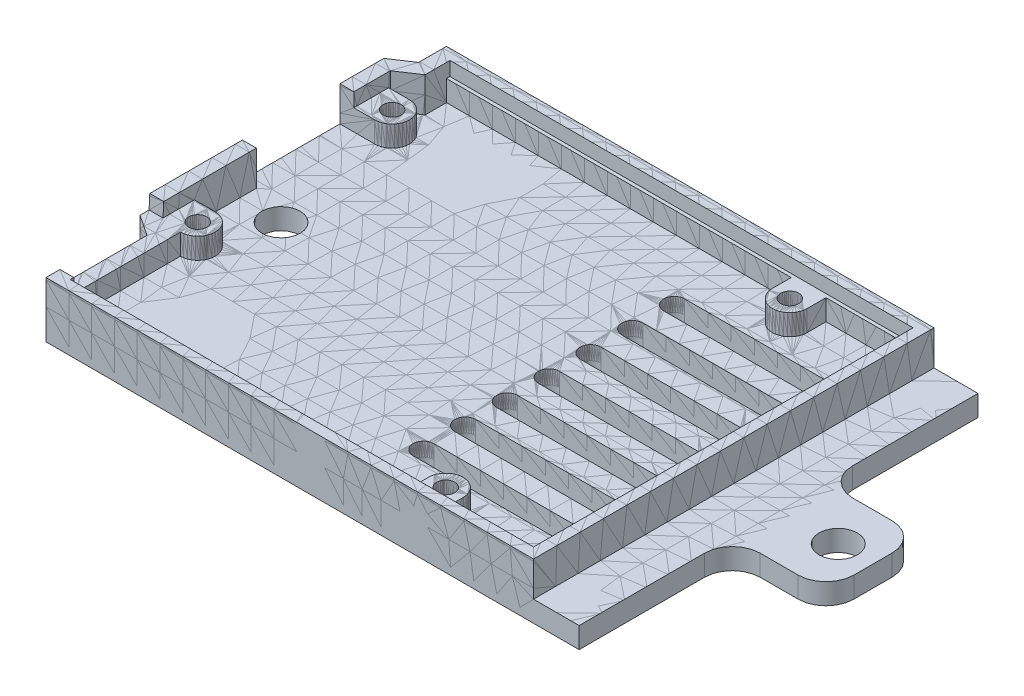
SolidWorks part; units mm, degrees
ref_plane "Alzado" through (0, 0, 0) normal (0, 0, 1) x (1, 0, 0)
ref_plane "Planta" through (0, 0, 0) normal (0, 1, 0) x (1, 0, 0)
ref_plane "Vista lateral" through (0, 0, 0) normal (1, 0, 0) x (0, 0, -1)
imported_body "Sólido importado1"
sketch "Croquis5" plane through (0, -1, 0) normal (0, -1, 0) x (1, 0, 0)
  line L0 (-66.2, 50.3497) -> (-66.2, 47.1503) construction
  line L1 (-66.2, 10.3498) -> (-66.2, 7.1502) construction
  line L2 (-4, 54.7494) -> (-4, 51.5506) construction
  line L3 (-4, 5.9494) -> (-4, 2.7506) construction
  circle A4 centre (-66.2, 48.75) radius 2.4326
  circle A5 centre (-66.2, 8.75) radius 2.6048
  circle A6 centre (-4, 53.15) radius 2.0466
  circle A7 centre (-4, 4.35) radius 2.0768
extrude "Saliente-Extruir4" add sketch "Croquis5" against normal up to vertex
sketch "Croquis6" plane through (0, 1, 0) normal (0, 1, 0) x (1, 0, 0)
  line L0 (-66.2, -53.65) -> (-71.3923, -53.65)
  line L1 (-64.8667, -53.65) -> (-67.5333, -53.65) construction
  line L2 (-71.3923, -53.65) -> (-71.3923, -48.7947)
  line L3 (-73.1, -48.7947) -> (-70.2, -48.7947) construction
  line L4 (-66.2, -53.65) -> (-61.3923, -53.65)
  line L5 (-61.3923, -53.65) -> (-61.3923, -48.7947)
  line L6 (-62.2, -48.7947) -> (-58.9375, -48.7947) construction
  line L7 (-71.3923, -48.7947) -> (-61.3923, -48.7947) construction
  line L8 (-70.2, -7.525) -> (-62.2, -7.525) construction
  line L10 (-70.2, -8.75) -> (-70.2, -6.3) construction
  line L12 (-62.2, -8.75) -> (-62.2, -6.3) construction
  line L13 (-66.2, -7.525) -> (-66.2, -3.85) construction
  line L15 (-66.849, -3.85) -> (-63.4947, -3.85) construction
  line L16 (-66.2, -3.85) -> (-71.2, -3.85)
  line L17 (-66.2, -3.85) -> (-61.2, -3.85)
  line L18 (-71.2, -3.85) -> (-71.2, -8.5431)
  line L19 (-70.2, -8.5431) -> (-72.0199, -8.5431) construction
  line L20 (-61.2, -3.85) -> (-61.2, -8.5431)
  line L21 (-58.9375, -8.5431) -> (-62.2, -8.5431) construction
  line L22 (-71.2, -8.5431) -> (-61.2, -8.5431) construction
  arc A1 (-61.3923, -48.7947) -> (-71.3923, -48.7947) centre (-66.3923, -48.7947) ccw
  arc A2 (-71.2, -8.5431) -> (-61.2, -8.5431) centre (-66.2, -8.5431) ccw
  dimension "D1" = 10
  dimension "D2" = 10
  dimension "D3" = 5
extrude "Saliente-Extruir5" add sketch "Croquis6" along normal up to vertex
sketch "Croquis7" plane through (0, 2, 0) normal (0, 1, 0) x (1, 0, 0)
  line L0 (-8, 0) -> (-8, -57.5)
  line L1 (-8, 0) -> (12, 0)
  line L2 (-8, -57.5) -> (12, -57.5)
  line L3 (12, 0) -> (12, -57.5)
  dimension "D1" = 20
extrude "Saliente-Extruir6" add sketch "Croquis7" against normal up to vertex
sketch "Croquis9" plane through (0, 2, 0) normal (0, 1, 0) x (1, 0, 0)
  line L0 (12, 0) -> (12, -22)
  line L1 (12, 0) -> (-1.6789, 0)
  line L2 (12, -22) -> (-1.6789, -22)
  line L3 (-1.6789, 0) -> (-1.6789, -22)
  line L4 (12, -57.5) -> (12, 0) construction
  line L5 (12, -57.5) -> (12, -35.5)
  line L6 (12, -57.5) -> (-1.4481, -57.5)
  line L7 (12, -35.5) -> (-1.4481, -35.5)
  line L8 (-1.4481, -57.5) -> (-1.4481, -35.5)
  line L9 (7, -28.75) -> (-73, -28.75) construction
  circle A0 centre (7, -28.75) radius 2.75
  circle A1 centre (-73, -28.75) radius 2.75
  dimension "D3" = 5.5
  dimension "D7" = 5.5
  dimension "D1" = 22
  dimension "D2" = 22
  dimension "D4" = 5
  dimension "D5" = 28.75
  dimension "D6" = 80
extrude "Cortar-Extruir3" cut sketch "Croquis9" against normal through all and the other way through all
fillet "Redondeo2" radius 4
fillet "Redondeo3" radius 4
sketch "Croquis10" plane through (0, 0, 0) normal (0, -1, 0) x (1, 0, 0)
  circle A0 centre (7, 28.75) radius 2.75 construction
  circle A1 centre (7, 28.75) radius 2.75
  circle A2 centre (7, 28.75) radius 4
  circle A3 centre (-73, 28.75) radius 4
  circle A4 centre (-73, 28.75) radius 2.75
  dimension "D1" = 8
  dimension "D2" = 8
extrude "Saliente-Extruir8" add sketch "Croquis10" along normal up to vertex
sketch "Croquis11" plane through (0, 7, 0) normal (0, 1, 0) x (1, 0, 0)
  line L0 (-37.0196, -52.149) -> (-35.4459, -52.149)
  line L1 (-43, -55.5) -> (-37.0196, -55.5)
  line L2 (-43, -55.5) -> (-43, -52.149)
  line L3 (-43, -52.149) -> (-37.0196, -52.149)
  line L5 (-37.0196, -52.149) -> (-33.8721, -52.149) construction
  line L6 (-35.4459, -52.149) -> (-35.45, -55.5)
  line L7 (-33.9, -55.5) -> (-37, -55.5) construction
  line L8 (-35.45, -55.5) -> (-37.0196, -55.5)
extrude "Cortar-Extruir4" cut sketch "Croquis11" against normal up to vertex
sketch "Croquis12" plane through (0, 7, 0) normal (0, 1, 0) x (1, 0, 0)
  line L1 (-42, -56) -> (-38, -56)
  line L2 (-42, -56) -> (-42, -57.5)
  line L3 (-42, -57.5) -> (-38, -57.5)
  line L4 (-38, -56) -> (-38, -57.5)
extrude "Saliente-Extruir9" add sketch "Croquis12" against normal up to vertex
sketch "Croquis13" plane through (0, 7, 0) normal (0, 1, 0) x (1, 0, 0)
  line L0 (-76, -2) -> (-76, -1.5)
  line L1 (-76, -1.5) -> (-9.5, -1.5)
  line L2 (-9.5, -1.5) -> (-9.5, -56)
  line L3 (-9.5, -56) -> (-76, -56)
  line L4 (-76, -56) -> (-76, -55.5)
  line L5 (-76, -55.5) -> (-76, -54.894)
  line L6 (-76, -52.149) -> (-76, -55.5) construction
  line L7 (-76, -54.894) -> (-10.3546, -54.894)
  line L8 (-10.3546, -54.894) -> (-10.3546, -2.3852)
  line L9 (-10.3546, -2.3852) -> (-76, -2.3852)
  line L10 (-76, -2) -> (-76, -5.0704) construction
  line L11 (-76, -2.3852) -> (-76, -2)
  line L12 (-76, -2) -> (-72.7, -2) construction
  line L13 (-10, -2) -> (-10, -3.8345) construction
  line L15 (-10, -55.5) -> (-13, -55.5) construction
  dimension "D1" = 0.5
  dimension "D2" = 0.5
  dimension "D3" = 0.5
extrude "Cortar-Extruir5" cut sketch "Croquis13" against normal up to vertex
sketch "Croquis14" plane through (0, 5, 0) normal (0, -1, 0) x (1, 0, 0)
  line L0 (-27.1843, 57.5) -> (-23.2157, 57.5)
  line L1 (-23.2157, 57.5) -> (-23.1183, 55.7006)
  line L2 (-23.2157, 57.5) -> (-23.0344, 54.1491) construction
  line L3 (-23.1183, 55.7006) -> (-27.1843, 55.605)
  line L4 (-27.1843, 55.605) -> (-27.1843, 57.5)
  line L5 (-25.9843, 0) -> (-22.0157, 0)
  line L6 (-22.0157, 0) -> (-22.0157, 2.032)
  line L7 (-22.0157, 2.032) -> (-26.0861, 2.032)
  line L8 (-26.3492, 3.8455) -> (-25.8612, 0.482) construction
  line L9 (-26.0861, 2.032) -> (-25.9843, 0)
extrude "Saliente-Extruir10" add sketch "Croquis14" along normal up to vertex
sketch "Croquis15" plane through (0, 7, 0) normal (0, 1, 0) x (1, 0, 0)
  line L1 (-42, 0) -> (-38, 0)
  line L2 (-42, 0) -> (-42, 1.5)
  line L3 (-42, 1.5) -> (-38, 1.5)
  line L4 (-38, 0) -> (-38, 1.5)
extrude "Cortar-Extruir6" cut sketch "Croquis15" against normal up to vertex
sketch "Croquis16" plane through (0, 0, 0) normal (0, -1, 0) x (1, 0, 0)
  line L0 (-78, 43) -> (-78, 57.5)
  line L1 (-78, 57.5) -> (-1.4481, 57.5)
  line L2 (-1.4481, 57.5) -> (-1.4481, 40.7318)
  line L3 (-78, 43) -> (-81, 41)
  line L4 (-81, 41) -> (-81, 6)
  line L5 (-81, 6) -> (-78, 4)
  line L6 (-78, 4) -> (-78, 0)
  line L7 (-78, 0) -> (-1.6789, 0)
  line L8 (-1.6789, 0) -> (-1.6789, 18)
  line L9 (-34.5, 48.3) -> (-14.5, 48.3)
  line L10 (2.3211, 22) -> (8, 22) construction
  line L11 (-14.5, 45.3) -> (-34.5, 45.3)
  line L12 (12, 31.5) -> (12, 26) construction
  line L13 (-34.5, 42.3) -> (-14.5, 42.3)
  line L14 (8, 35.5) -> (2.5519, 35.5) construction
  line L15 (-14.5, 39.3) -> (-34.5, 39.3)
  line L16 (-1.4481, 39.5) -> (-1.4481, 40.7318) construction
  line L17 (-34.5, 33.3) -> (-14.5, 33.3)
  line L18 (2.3211, 22) -> (8, 22)
  line L19 (-14.5, 36.3) -> (-34.5, 36.3)
  line L20 (12, 31.5) -> (12, 26)
  line L21 (-34.5, 30.3) -> (-14.5, 30.3)
  line L22 (8, 35.5) -> (2.5519, 35.5)
  line L23 (-14.5, 27.3) -> (-34.5, 27.3)
  line L24 (-1.4481, 39.5) -> (-1.4481, 40.7318)
  line L25 (-34.5, 24.3) -> (-14.5, 24.3)
  line L27 (-14.5, 21.3) -> (-34.5, 21.3)
  line L29 (-34.5, 18.3) -> (-14.5, 18.3)
  line L31 (-14.5, 15.3) -> (-34.5, 15.3)
  line L33 (-34.5, 12.3) -> (-14.5, 12.3)
  line L35 (-14.5, 9.3) -> (-34.5, 9.3)
  line L36 (-31.1667, 9.3) -> (-34.5, 9.3) construction
  circle A1 centre (-76.009, 37.7279) radius 1.304
  circle A2 centre (-76.009, 9.7678) radius 1.3333
  circle A3 centre (-24.0882, 4.7329) radius 1.665
  circle A4 centre (-25.2266, 52.9678) radius 2.1843
  arc A5 (-14.5, 45.3) -> (-14.5, 48.3) centre (-14.5, 46.8) ccw
  arc A6 (-34.5, 48.3) -> (-34.5, 45.3) centre (-34.5, 46.8) ccw
  arc A7 (-14.5, 39.3) -> (-14.5, 42.3) centre (-14.5, 40.8) ccw
  arc A8 (-34.5, 42.3) -> (-34.5, 39.3) centre (-34.5, 40.8) ccw
  arc A9 (-14.5, 33.3) -> (-14.5, 36.3) centre (-14.5, 34.8) ccw
  arc A10 (-34.5, 36.3) -> (-34.5, 33.3) centre (-34.5, 34.8) ccw
  arc A11 (-14.5, 27.3) -> (-14.5, 30.3) centre (-14.5, 28.8) ccw
  arc A12 (-34.5, 30.3) -> (-34.5, 27.3) centre (-34.5, 28.8) ccw
  arc A13 (-14.5, 21.3) -> (-14.5, 24.3) centre (-14.5, 22.8) ccw
  arc A14 (-34.5, 24.3) -> (-34.5, 21.3) centre (-34.5, 22.8) ccw
  arc A15 (-14.5, 15.3) -> (-14.5, 18.3) centre (-14.5, 16.8) ccw
  arc A16 (-34.5, 18.3) -> (-34.5, 15.3) centre (-34.5, 16.8) ccw
  arc A17 (-14.5, 9.3) -> (-14.5, 12.3) centre (-14.5, 10.8) ccw
  arc A18 (-34.5, 12.3) -> (-34.5, 9.3) centre (-34.5, 10.8) ccw
  circle A19 centre (7, 28.75) radius 2.75 construction
  arc A20 (-1.5826, 18.8726) -> (-1.6789, 18) centre (2.3211, 18) ccw construction
  arc A21 (-0.7135, 20.606) -> (-1.5826, 18.8726) centre (2.3211, 18) ccw construction
  arc A22 (-0.3568, 20.9714) -> (-0.7135, 20.606) centre (2.3211, 18) ccw construction
  arc A23 (2.3211, 22) -> (-0.3568, 20.9714) centre (2.3211, 18) ccw construction
  arc A24 (8, 22) -> (12, 26) centre (8, 26) ccw construction
  arc A25 (12, 31.5) -> (8, 35.5) centre (8, 31.5) ccw construction
  arc A26 (-0.8385, 37.3775) -> (2.5519, 35.5) centre (2.5519, 39.5) ccw construction
  arc A27 (-1.3858, 38.7968) -> (-0.8385, 37.3775) centre (2.5519, 39.5) ccw construction
  arc A28 (-1.4481, 39.5) -> (-1.3858, 38.7968) centre (2.5519, 39.5) ccw construction
  circle A29 centre (7, 28.75) radius 2.75
  arc A30 (-1.5826, 18.8726) -> (-1.6789, 18) centre (2.3211, 18) ccw
  arc A31 (-0.7135, 20.606) -> (-1.5826, 18.8726) centre (2.3211, 18) ccw
  arc A32 (-0.3568, 20.9714) -> (-0.7135, 20.606) centre (2.3211, 18) ccw
  arc A33 (2.3211, 22) -> (-0.3568, 20.9714) centre (2.3211, 18) ccw
  arc A34 (8, 22) -> (12, 26) centre (8, 26) ccw
  arc A35 (12, 31.5) -> (8, 35.5) centre (8, 31.5) ccw
  arc A36 (-0.8385, 37.3775) -> (2.5519, 35.5) centre (2.5519, 39.5) ccw
  arc A37 (-1.3858, 38.7968) -> (-0.8385, 37.3775) centre (2.5519, 39.5) ccw
  arc A38 (-1.4481, 39.5) -> (-1.3858, 38.7968) centre (2.5519, 39.5) ccw
  circle A39 centre (-73, 28.75) radius 2.75
extrude "Saliente-Extruir11" add sketch "Croquis16" along normal up to vertex
sketch "Croquis17" plane through (0, 0, 0) normal (0, 1, 0) x (1, 0, 0)
  line L0 (-81, -10.7843) -> (-81, -6.8157) construction
  line L1 (-81, -39.6843) -> (-81, -35.7157) construction
  line L2 (-81, -10.7843) -> (-81, -6.8157)
  line L3 (-81, -39.6843) -> (-81, -35.7157)
  line L4 (-81, -6.8157) -> (-79.05, -6.8157)
  line L5 (-79.05, -6.8157) -> (-79, -10.7843)
  line L6 (-79, -12.3) -> (-79, -10.5431) construction
  line L7 (-79, -10.7843) -> (-81, -10.7843)
  line L8 (-81, -35.7157) -> (-79, -35.7004)
  line L9 (-79, -37.3775) -> (-79, -34.0232) construction
  line L10 (-79, -35.7004) -> (-79, -39.6476)
  line L11 (-79, -39.7) -> (-79, -39.5952) construction
  line L12 (-79, -39.6476) -> (-81, -39.6843)
extrude "Saliente-Extruir12" add sketch "Croquis17" along normal up to vertex
